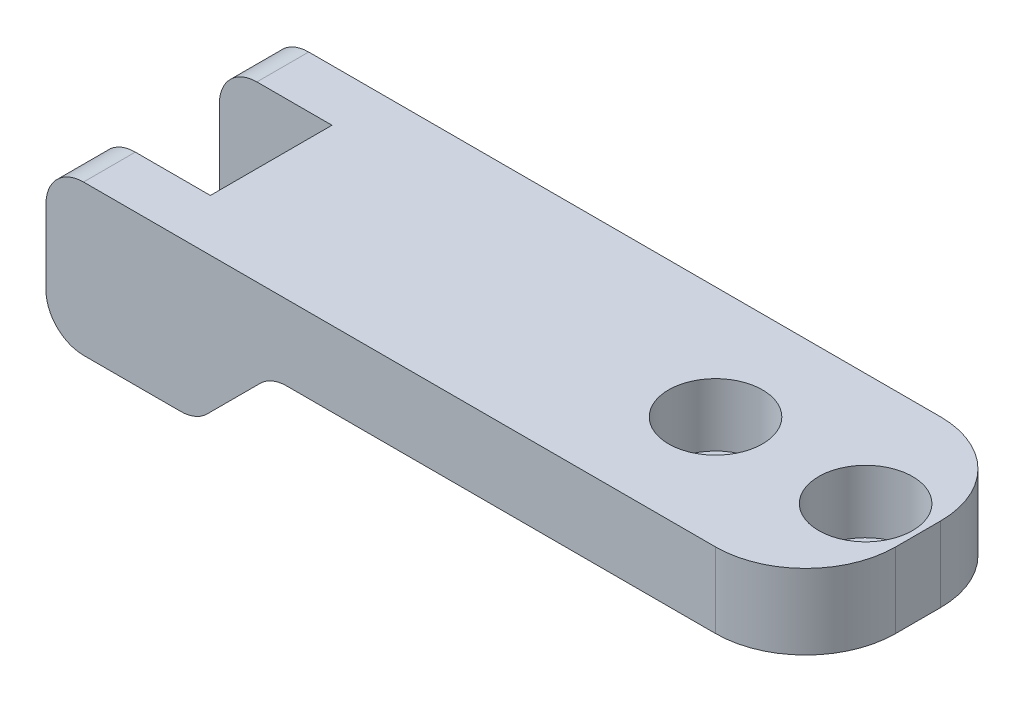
SolidWorks part; units mm, degrees
ref_plane "Front Plane" through (0, 0, 0) normal (0, 0, 1) x (1, 0, 0)
ref_plane "Top Plane" through (0, 0, 0) normal (0, 1, 0) x (1, 0, 0)
ref_plane "Right Plane" through (0, 0, 0) normal (1, 0, 0) x (0, 0, -1)
sketch "Sketch1" plane through (0, 0, 0) normal (0, 0, 1) x (1, 0, 0)
  line L0 (0, 0) -> (45.212, 0)
  line L1 (-6.35, -6.35) -> (0, 0)
  line L2 (-6.35, -6.35) -> (-19.05, -6.35)
  line L3 (-19.05, -6.35) -> (-19.05, 6.35)
  line L4 (-19.05, 6.35) -> (45.212, 6.35)
  line L5 (45.212, 6.35) -> (45.212, 0)
  dimension "D1" = 6.35
  dimension "D2" = 135
  dimension "D3" = 12.7
  dimension "D4" = 12.7
  dimension "D5" = 64.262
extrude "Boss-Extrude1" add sketch "Sketch1" along normal mid plane 19.05
sketch "Sketch2" plane through (0, 6.35, 0) normal (0, 1, 0) x (1, 0, 0)
  line L0 (-19.05, -9.525) -> (-19.05, 9.525) construction
  line L1 (-9.525, -5.1435) -> (-19.05, -5.1435)
  line L2 (-9.525, -5.1435) -> (-9.525, 5.1435)
  line L3 (-9.525, 5.1435) -> (-19.05, 5.1435)
  line L4 (-19.05, -5.1435) -> (-19.05, 5.1435)
  line L5 (-9.525, -5.1435) -> (-19.05, 5.1435) construction
  line L6 (-9.525, 5.1435) -> (-19.05, -5.1435) construction
  point P0 (-14.2875, 0)
  dimension "D1" = 10.287
  dimension "D2" = 9.525
extrude "Cut-Extrude1" cut sketch "Sketch2" against normal through all
hole_wizard "CBORE for #8 Socket Head Cap Screw1" positions "Sketch4" profile "Sketch3" counterbore size "#8" standard "ANSI Inch"
sketch "Sketch4" plane through (0, 6.35, 0) normal (0, 1, 0) x (1, 0, 0)
  line L0 (0, 0) -> (40.767, 0) construction
  line L1 (45.212, -9.525) -> (45.212, 9.525) construction
  point P0 (40.767, 0)
  point P2 (28.067, 0)
  dimension "D1" = 4.445
  dimension "D2" = 12.7
sketch "Sketch3" plane through (40.767, 6.35, 0) normal (1, 0, 0) x (0, 0, 1)
  line L0 (0, 0) -> (0, 12.7)
  line L1 (0, 12.7) -> (2.4574, 12.7)
  line L3 (2.4574, 12.7) -> (2.4574, 5.3086)
  line L4 (2.4574, 5.3086) -> (3.9687, 5.3086)
  line L5 (3.9687, 5.3086) -> (3.9687, 0)
  line L7 (3.9687, 0) -> (0, 0)
  line L11 (0, -6.35) -> (0, 107.95) construction
  dimension "Thru Hole Dia." = 4.9149
  dimension "Thru Hole Depth" = 12.7
  dimension "C'Bore Dia." = 7.9375
  dimension "C'Bore Depth" = 5.3086
fillet "Fillet1" radius 7.62 2 edges at (45.212, 3.175, -9.525) (45.212, 3.175, 9.525)
fillet "Fillet2" radius 3.175 6 edges at (-6.35, -6.35, 0) (0, 0, 0) (-19.05, -6.35, -7.3343) (-19.05, -6.35, 7.3342) (-19.05, 6.35, -7.3343) (-19.05, 6.35, 7.3342)
